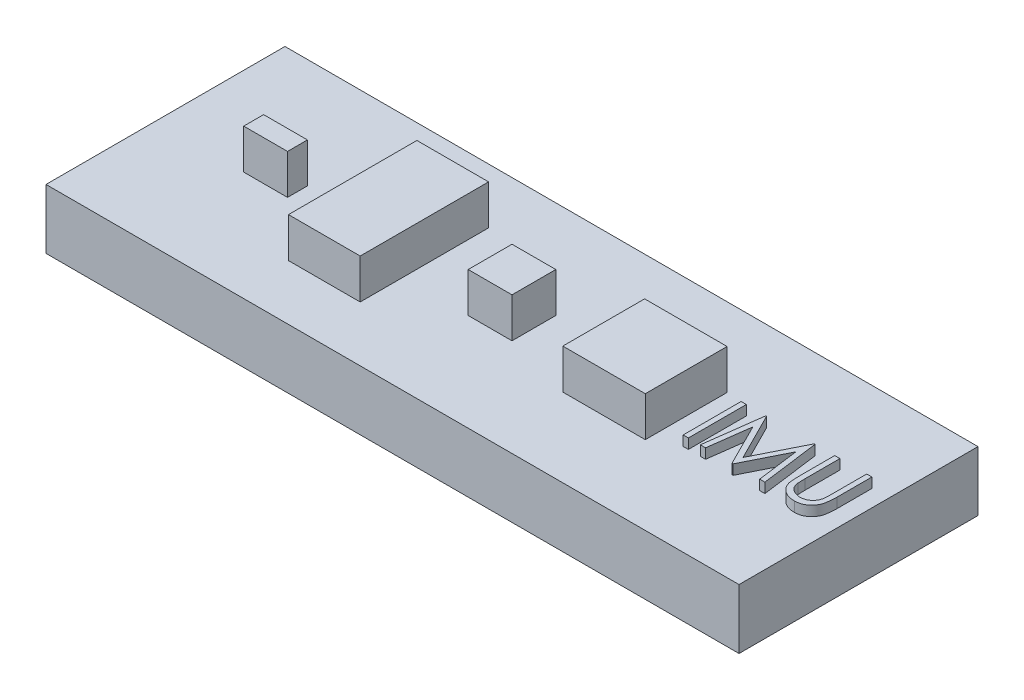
SolidWorks part; units mm, degrees
ref_plane "Front Plane" through (0, 0, 0) normal (0, 0, 1) x (1, 0, 0)
ref_plane "Top Plane" through (0, 0, 0) normal (0, 1, 0) x (1, 0, 0)
ref_plane "Right Plane" through (0, 0, 0) normal (1, 0, 0) x (0, 0, -1)
sketch "Sketch1" plane through (0, 0, 0) normal (0, 1, 0) x (1, 0, 0)
  line L1 (0, 0) -> (34.8, 0)
  line L2 (0, 0) -> (0, 12)
  line L3 (0, 12) -> (34.8, 12)
  line L4 (34.8, 0) -> (34.8, 12)
  dimension "D1" = 34.8
  dimension "D2" = 12
extrude "Boss-Extrude2" add sketch "Sketch1" along normal blind 3
sketch "Sketch4" plane through (0, 3, 0) normal (0, 1, 0) x (1, 0, 0)
  line L1 (17.4, 12) -> (17.4, 0) construction
  line L2 (34.8, 12) -> (0, 12) construction
  line L3 (0, 0) -> (34.8, 0) construction
  line L4 (24.076, 12) -> (24.076, 0) construction
  line L6 (11.2002, 12) -> (11.2002, 0) construction
  line L7 (5.5277, 12) -> (5.5277, 0) construction
  line L9 (22.005, 3.9463) -> (26.1469, 3.9463)
  line L10 (22.005, 3.9463) -> (22.005, 8.0537)
  line L11 (22.005, 8.0537) -> (26.1469, 8.0537)
  line L12 (26.1469, 3.9463) -> (26.1469, 8.0537)
  line L13 (22.005, 3.9463) -> (26.1469, 8.0537) construction
  line L14 (22.005, 8.0537) -> (26.1469, 3.9463) construction
  line L15 (16.3, 4.9) -> (18.5, 4.9)
  line L16 (16.3, 4.9) -> (16.3, 7.1)
  line L17 (16.3, 7.1) -> (18.5, 7.1)
  line L18 (18.5, 4.9) -> (18.5, 7.1)
  line L19 (16.3, 4.9) -> (18.5, 7.1) construction
  line L20 (16.3, 7.1) -> (18.5, 4.9) construction
  line L21 (9.3994, 2.7758) -> (13.001, 2.7758)
  line L22 (9.3994, 2.7758) -> (9.3994, 9.2242)
  line L23 (9.3994, 9.2242) -> (13.001, 9.2242)
  line L24 (13.001, 2.7758) -> (13.001, 9.2242)
  line L25 (9.3994, 2.7758) -> (13.001, 9.2242) construction
  line L26 (9.3994, 9.2242) -> (13.001, 2.7758) construction
  line L27 (4.4277, 5.5) -> (6.6277, 5.5)
  line L28 (4.4277, 5.5) -> (4.4277, 6.5)
  line L29 (4.4277, 6.5) -> (6.6277, 6.5)
  line L30 (6.6277, 5.5) -> (6.6277, 6.5)
  line L31 (4.4277, 5.5) -> (6.6277, 6.5) construction
  line L32 (4.4277, 6.5) -> (6.6277, 5.5) construction
  point P12 (5.5277, 6)
  point P13 (11.2002, 6)
  point P14 (17.4, 6)
  point P15 (24.076, 6)
  point P16 (24.076, 6)
  point P21 (17.4, 6)
  point P26 (11.2002, 6)
  point P31 (5.5277, 6)
  dimension "D1" = 2.2
  dimension "D2" = 2.2
  dimension "D3" = 2.2
  dimension "D4" = 1
extrude "Boss-Extrude3" add sketch "Sketch4" along normal blind 2
ref_point "Point1"
ref_point "Point2"
ref_point "Point3"
ref_point "Point4"
ref_point "Point5"
ref_point "Point6"
ref_point "Point7"
ref_point "Point8"
ref_plane "Plane1" through (17.4, 0, 0) normal (1, 0, 0) x (0, 0, -1)
ref_plane "Plane2" through (0, 0, -6) normal (0, 0, -1) x (-1, 0, 0)
sketch "Sketch5" plane through (0, 3, 0) normal (0, 1, 0) x (1, 0, 0)
  text T0 "IMU" font "Century Gothic" height in points 11
extrude "Boss-Extrude4" add sketch "Sketch5" along normal blind 0.5
